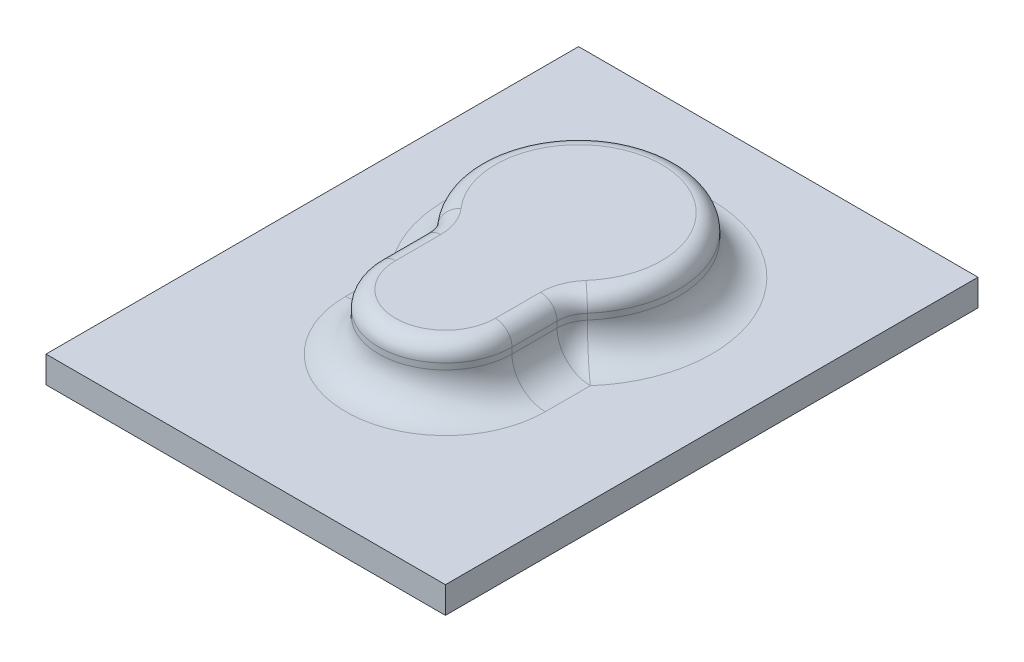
SolidWorks part; units mm, degrees
ref_plane "Front Plane" through (0, 0, 0) normal (0, 0, 1) x (1, 0, 0)
ref_plane "Top Plane" through (0, 0, 0) normal (0, 1, 0) x (1, 0, 0)
ref_plane "Right Plane" through (0, 0, 0) normal (1, 0, 0) x (0, 0, -1)
sketch "Sketch1" plane through (0, 0, 0) normal (0, 1, 0) x (1, 0, 0)
  line L1 (19.05, 19.05) -> (-19.05, 19.05)
  line L2 (19.05, 19.05) -> (19.05, -31.75)
  line L3 (19.05, -31.75) -> (-19.05, -31.75)
  line L4 (-19.05, 19.05) -> (-19.05, -31.75)
  line L5 (19.05, 19.05) -> (-19.05, -31.75) construction
  line L6 (19.05, -31.75) -> (-19.05, 19.05) construction
  point P0 (0, -6.35)
  dimension "D1" = 50.8
  dimension "D2" = 38.1
  dimension "D3" = 6.35
extrude "Boss-Extrude1" add sketch "Sketch1" along normal blind 2.54
sketch "Sketch2" plane through (0, 2.54, 0) normal (0, 1, 0) x (1, 0, 0)
  line L0 (0, 0) -> (0, -12.7) construction
  line L1 (6.35, -8.4003) -> (6.35, -12.7)
  line L2 (-6.35, -8.4003) -> (-6.35, -12.7)
  arc A0 (6.35, -8.4003) -> (7.1437, -6.3002) centre (9.525, -8.4003) cw
  arc A1 (-6.35, -12.7) -> (6.35, -12.7) centre (0, -12.7) ccw
  arc A2 (7.1437, -6.3002) -> (-7.1438, -6.3002) centre (0, 0) ccw
  arc A3 (-7.1438, -6.3002) -> (-6.35, -8.4003) centre (-9.525, -8.4003) cw
  point P3 (0, -12.7)
  dimension "D1" = 6.35
  dimension "D2" = 9.525
  dimension "D4" = 3.175
  dimension "D3" = 12.7
extrude "Boss-Extrude2" add sketch "Sketch2" along normal blind 5.334
fillet "Fillet1" radius 3.175 6 edges at (-6.35, 2.54, 10.5501) (-6.5551, 2.54, 7.2777) (0, 2.54, -9.525) (6.5551, 2.54, 7.2777) (6.35, 2.54, 10.5501) (0, 2.54, 19.05)
fillet "Fillet2" radius 1.5875 6 edges at (-6.35, 7.874, 10.5501) (-6.5551, 7.874, 7.2777) (0, 7.874, -9.525) (6.5551, 7.874, 7.2777) (6.35, 7.874, 10.5501) (0, 7.874, 19.05)
sketch "Sketch3" plane through (0, 7.874, 0) normal (0, 1, 0) x (1, 0, 0)
  line L0 (0, -12.7) -> (0, 0) construction
  line L1 (-1.5875, -12.7) -> (-1.5875, -2.7496)
  line L2 (1.5875, -12.7) -> (1.5875, -2.7496)
  arc A0 (-1.5875, -12.7) -> (1.5875, -12.7) centre (0, -12.7) ccw
  arc A2 (1.5875, -2.7496) -> (-1.5875, -2.7496) centre (0, 0) ccw
  dimension "D2" = 6.35
  dimension "D1" = 3.175
